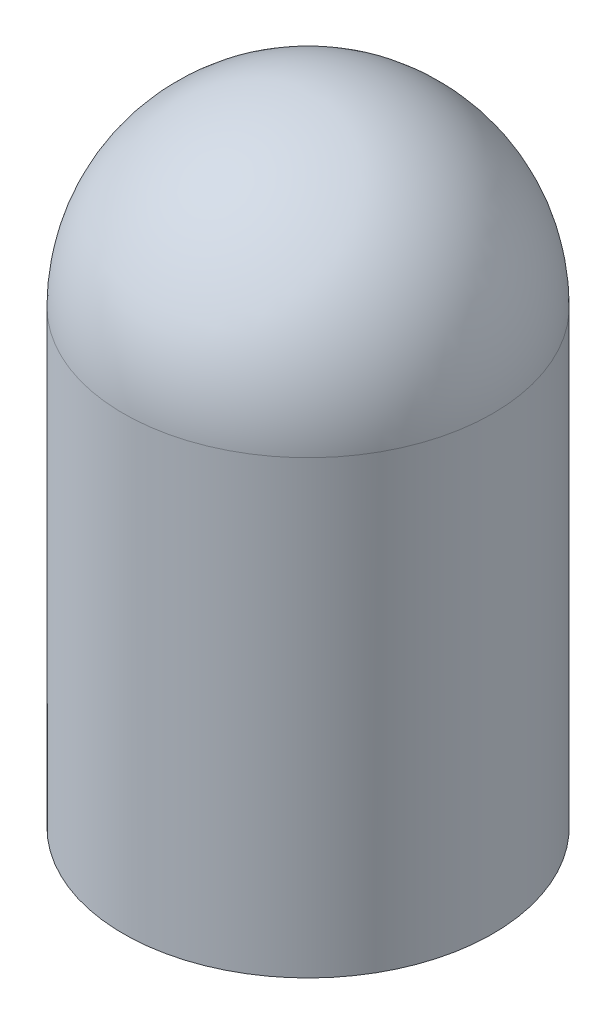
SolidWorks part; units mm, degrees
ref_plane "Front Plane" through (0, 0, 0) normal (0, 0, 1) x (1, 0, 0)
ref_plane "Top Plane" through (0, 0, 0) normal (0, 1, 0) x (1, 0, 0)
ref_plane "Right Plane" through (0, 0, 0) normal (1, 0, 0) x (0, 0, -1)
sketch "Sketch1" plane through (0, 0, 0) normal (0, 0, 1) x (1, 0, 0)
  line L0 (0, -1.6959) -> (0, 10.6426) construction
  line L1 (0, 0) -> (2.5, 0)
  line L3 (0, 0) -> (0, 8.6)
  line L4 (2.5, 0) -> (2.5, 6.1)
  arc A0 (0, 8.6) -> (2.5, 6.1) centre (0, 6.1) cw
  dimension "D2" = 8.6
  dimension "D1" = 2.5
revolve "Revolve5" add sketch "Sketch1" angle 360 about L0
sketch "Sketch2" plane through (0, 0, 0) normal (0, -1, 0) x (1, 0, 0)
  point P0 (0, 1.27)
  point P1 (0, -1.27)
  dimension "D1" = 2.54
  dimension "D2" = 1.27
